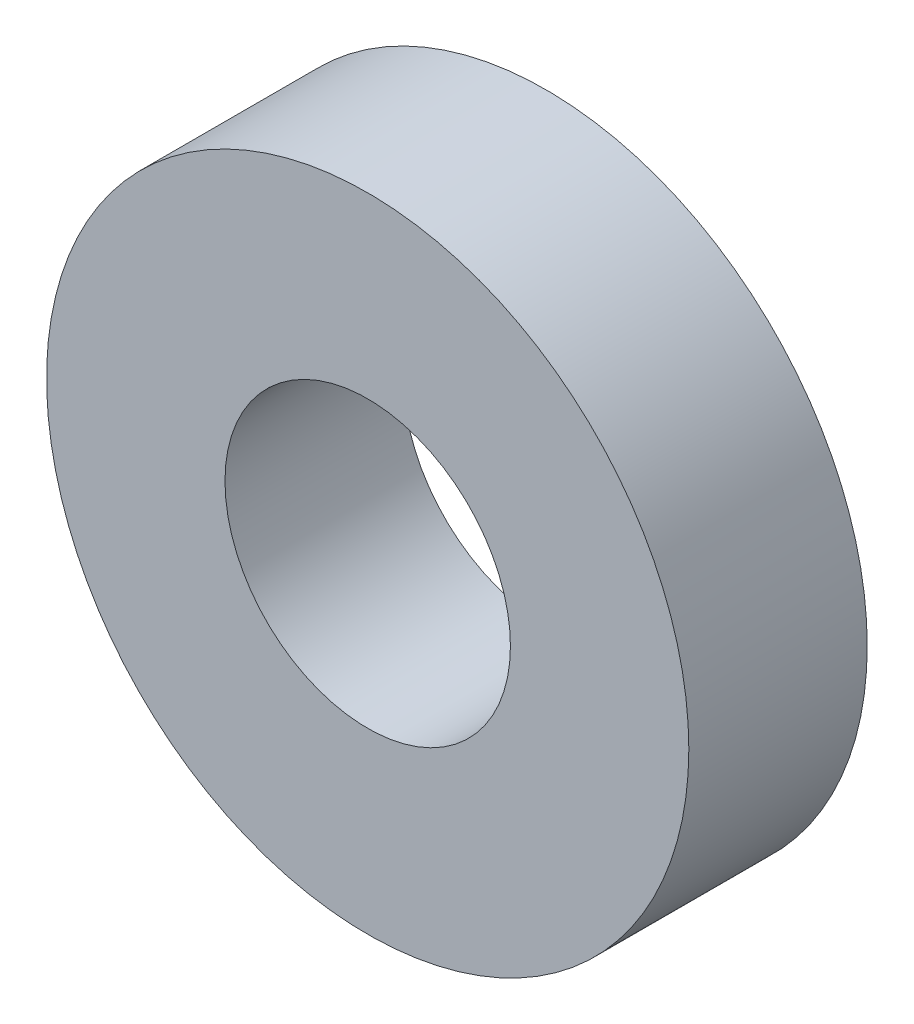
SolidWorks part; units mm, degrees
ref_plane "Front Plane" through (0, 0, 0) normal (0, 0, 1) x (1, 0, 0)
ref_plane "Top Plane" through (0, 0, 0) normal (0, 1, 0) x (1, 0, 0)
ref_plane "Right Plane" through (0, 0, 0) normal (1, 0, 0) x (0, 0, -1)
sketch "Sketch1" plane through (0, 0, 0) normal (0, 0, 1) x (1, 0, 0)
  circle A0 centre (0, 0) radius 14.2875
  circle A1 centre (0, 0) radius 6.35
  dimension "D1" = 12.7
  dimension "D2" = 28.575
extrude "Extrude1" add sketch "Sketch1" along normal blind 7.9375
